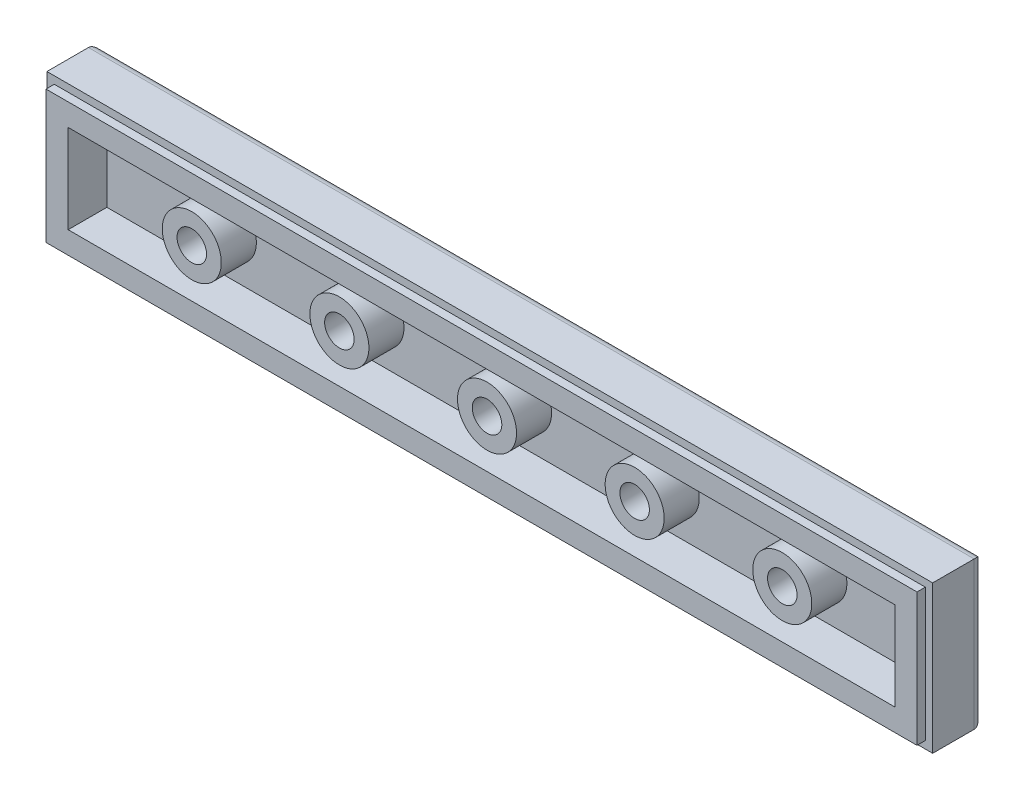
SolidWorks part; units mm, degrees
ref_plane "Vorne" through (0, 0, 0) normal (0, 0, 1) x (1, 0, 0)
ref_plane "Oben" through (0, 0, 0) normal (0, 1, 0) x (1, 0, 0)
ref_plane "Rechts" through (0, 0, 0) normal (1, 0, 0) x (0, 0, -1)
sketch "Skizze1" plane through (0, 0, 0) normal (0, 0, 1) x (1, 0, 0)
  line L1 (0, 0) -> (-48, 0)
  line L2 (0, 0) -> (0, -8)
  line L3 (0, -8) -> (-48, -8)
  line L4 (-48, 0) -> (-48, -8)
  dimension "D1" = 48
  dimension "D2" = 8
extrude "Linear austragen1" add sketch "Skizze1" along normal blind 3.2
sketch "Skizze2" plane through (0, 0, 3.2) normal (0, 0, 1) x (1, 0, 0)
  line L0 (-48, -8) -> (0, -8) construction
  line L1 (-1.6, -6.4) -> (-46.4, -6.4)
  line L2 (-1.6, -6.4) -> (-1.6, -1.6)
  line L3 (-1.6, -1.6) -> (-46.4, -1.6)
  line L4 (-46.4, -6.4) -> (-46.4, -1.6)
  line L5 (0, -8) -> (0, 0) construction
  line L6 (-48, 0) -> (-48, -8) construction
  line L7 (0, 0) -> (-48, 0) construction
  dimension "D1" = 1.6
  dimension "D2" = 1.6
  dimension "D3" = 1.6
  dimension "D4" = 1.6
extrude "Schnitt-Linear austragen1" cut sketch "Skizze2" against normal blind 2.1
sketch "Skizze3" plane through (0, 0, 1.1) normal (0, 0, 1) x (1, 0, 0)
  line L0 (0, -8) -> (0, 0) construction
  line L4 (-46.4, -6.4) -> (-1.6, -6.4) construction
  circle A0 centre (-7.9, -4) radius 1.6
  circle A1 centre (-7.9, -4) radius 0.8
  dimension "D1" = 3.2
  dimension "D2" = 1.6
  dimension "D3" = 7.9
  dimension "D4" = 2.4
extrude "Linear austragen2" add sketch "Skizze3" along normal blind 1.9
pattern_linear "Lineares Muster2" count 5 spacing 8 along (-1, 0, 0) of "Linear austragen2"
sketch "Skizze4" plane through (0, 0, 3.2) normal (0, 0, 1) x (1, 0, 0)
  line L0 (-48, -8) -> (0, -8) construction
  line L1 (-47.6, -0.4) -> (-0.4, -0.4)
  line L2 (-47.6, -0.4) -> (-47.6, -7.6)
  line L3 (-47.6, -7.6) -> (-0.4, -7.6)
  line L4 (-0.4, -0.4) -> (-0.4, -7.6)
  line L5 (0, -8) -> (0, 0) construction
  line L6 (0, 0) -> (-48, 0) construction
  line L7 (-48, 0) -> (-48, -8) construction
  point P10 (-48, -4)
  dimension "D1" = 0.4
  dimension "D2" = 0.4
  dimension "D3" = 0.4
  dimension "D4" = 0.4
extrude "Schnitt-Linear austragen2" cut sketch "Skizze4" against normal blind 0.45 flip side to cut
fillet "Verrundung1" radius 0.5 4 edges at (-24, -8, 0) (-48, -4, 0) (-24, 0, 0) (0, -4, 0)
